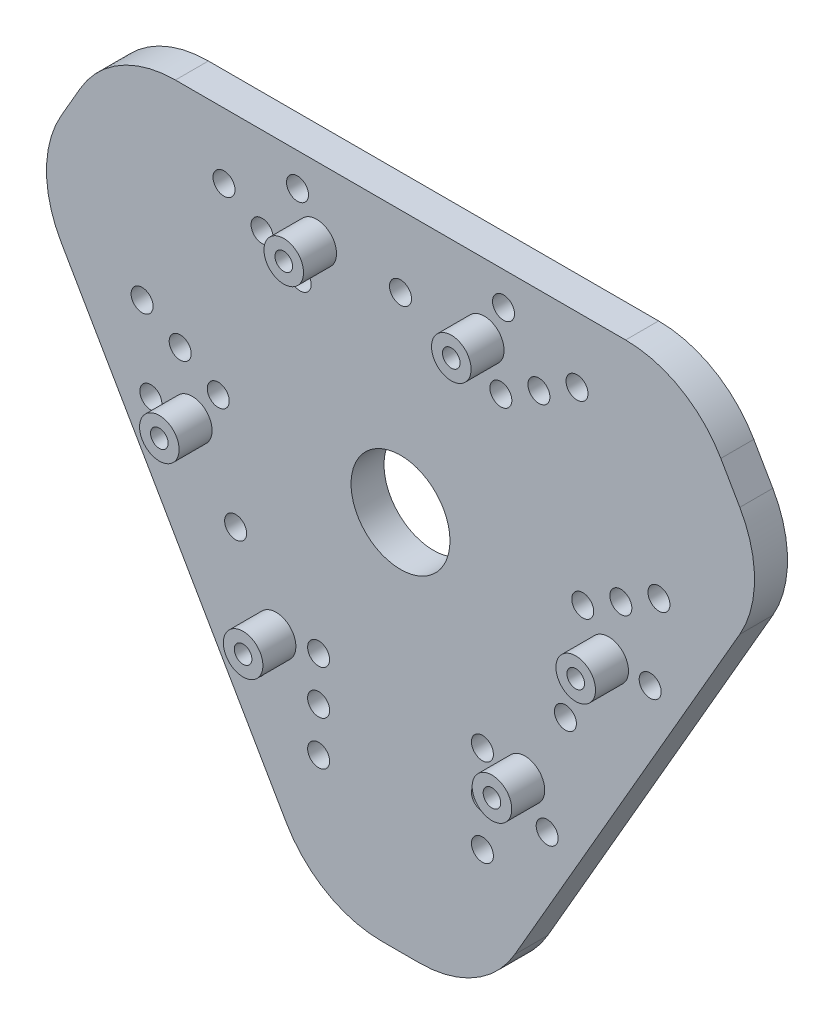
SolidWorks part; units mm, degrees
ref_plane "前视基准面" through (0, 0, 0) normal (0, 0, 1) x (1, 0, 0)
ref_plane "上视基准面" through (0, 0, 0) normal (0, 1, 0) x (1, 0, 0)
ref_plane "右视基准面" through (0, 0, 0) normal (1, 0, 0) x (0, 0, -1)
sketch "草图1" plane through (0, 0, 0) normal (0, 0, 1) x (1, 0, 0)
  line L0 (-7.5, -15.8) -> (7.5, -15.8)
  line L1 (7.5, -15.8) -> (33.75, 29.6663)
  line L2 (33.75, 29.6663) -> (26.25, 42.6567)
  line L3 (26.25, 42.6567) -> (-26.25, 42.6567)
  line L4 (-26.25, 42.6567) -> (-33.75, 29.6663)
  line L5 (-33.75, 29.6663) -> (-7.5, -15.8)
  line L6 (-30, 36.1615) -> (0, 18.841) construction
  line L7 (30, 36.1615) -> (0, 18.841) construction
  line L8 (0, 18.841) -> (0, -15.8) construction
  dimension "D1" = 15
extrude "凸台-拉伸1" add sketch "草图1" along normal blind 3
sketch "草图2" plane through (0, 0, 3) normal (0, 0, 1) x (1, 0, 0)
  circle A0 centre (-9.1277, 32.7134) radius 1 construction
  circle A1 centre (-12.5918, 34.7134) radius 1 construction
  circle A3 centre (-16.5777, 19.8096) radius 1 construction
  circle A5 centre (-20.0418, 21.8096) radius 1 construction
  circle A9 centre (-23.5059, 23.8096) radius 1 construction
  circle A13 centre (-16.0559, 36.7134) radius 1 construction
  circle A14 centre (-9.1277, 32.7134) radius 1
  circle A15 centre (-12.5918, 34.7134) radius 1
  circle A16 centre (-16.5777, 19.8096) radius 1
  circle A17 centre (-20.0418, 21.8096) radius 1
  circle A18 centre (-23.5059, 23.8096) radius 1
  circle A19 centre (-16.0559, 36.7134) radius 1
extrude "切除-拉伸1" cut sketch "草图2" against normal through all
sketch "草图3" plane through (0, 0, 3) normal (0, 0, 1) x (1, 0, 0)
  circle A0 centre (0, 18.841) radius 4.5
  dimension "D1" = 9
extrude "切除-拉伸2" cut sketch "草图3" against normal through all
sketch "草图4" plane through (0, 0, 3) normal (0, 0, 1) x (1, 0, 0)
  line L0 (-30, 36.1615) -> (0, -15.8) construction
  line L1 (-32.0179, 32.6663) -> (-4.0359, -15.8) construction
  line L2 (-26.25, 42.6567) -> (-33.75, 29.6663) construction
  line L3 (-7.5, -15.8) -> (7.5, -15.8) construction
  line L4 (-33.75, 29.6663) -> (-7.5, -15.8) construction
  line L5 (-22.7116, 16.5472) -> (-15, 10.1808) construction
  line L6 (-15, 10.1808) -> (-13.3423, 0.3191) construction
  line L7 (-13.3423, 0.3191) -> (-22.7116, 16.5472) construction
  circle A0 centre (-15, 10.1808) radius 1
  circle A1 centre (-22.7116, 16.5472) radius 1
  circle A2 centre (-13.3423, 0.3191) radius 1
  dimension "D1" = 2
  dimension "D3" = 10
  dimension "D4" = 2
  dimension "D2" = 3
extrude "切除-拉伸3" cut sketch "草图4" against normal through all
pattern_circular "阵列(圆周)1" count 3 over 360 about axis through (0, 18.841, 0) along (0, 0, 1) of "切除-拉伸1", "切除-拉伸3"
fillet "圆角1" radius 10 6 edges at (26.25, 42.6567, 1.5) (33.75, 29.6663, 1.5) (-26.25, 42.6567, 1.5) (-33.75, 29.6663, 1.5) (-7.5, -15.8, 1.5) (7.5, -15.8, 1.5)
sketch "草图5" plane through (0, 0, 3) normal (0, 0, 1) x (1, 0, 0)
  circle A0 centre (7.62, 36.3095) radius 0.8 construction
  circle A1 centre (-7.62, 36.3095) radius 0.8 construction
  circle A2 centre (7.62, 36.3095) radius 0.8
  circle A3 centre (-7.62, 36.3095) radius 0.8
extrude "切除-拉伸4" cut sketch "草图5" against normal through all
sketch "草图6" plane through (0, 0, 3) normal (0, 0, 1) x (1, 0, 0)
  circle A0 centre (7.62, 36.3095) radius 0.8 construction
  circle A1 centre (-7.62, 36.3095) radius 0.8 construction
  circle A2 centre (7.62, 36.3095) radius 0.8
  circle A3 centre (-7.62, 36.3095) radius 0.8
extrude "拉伸-薄壁1" add sketch "草图6" along normal blind 3 thin
pattern_circular "阵列(圆周)2" count 3 over 360 about axis through (0, 18.841, 0) along (0, 0, 1) of "拉伸-薄壁1", "切除-拉伸4"
